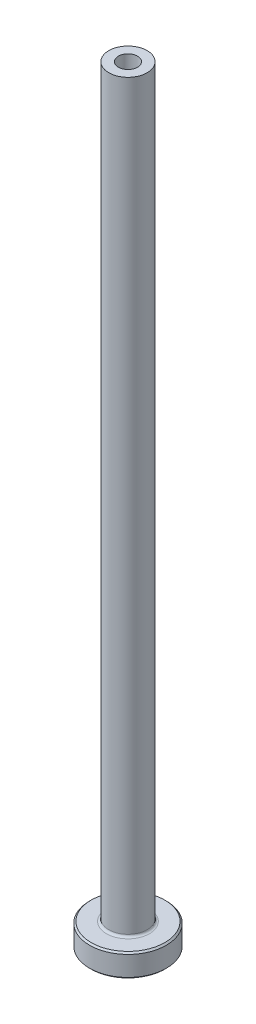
SolidWorks part; units mm, degrees
ref_plane "Front Plane" through (0, 0, 0) normal (0, 0, 1) x (1, 0, 0)
ref_plane "Top Plane" through (0, 0, 0) normal (0, 1, 0) x (1, 0, 0)
ref_plane "Right Plane" through (0, 0, 0) normal (1, 0, 0) x (0, 0, -1)
sketch "Sketch1" plane through (0, 0, 0) normal (0, 0, 1) x (1, 0, 0)
  line L0 (-1.25, 100) -> (-2.5, 100)
  line L1 (-2.5, 100) -> (-2.5, 3)
  line L2 (-2.5, 3) -> (-5, 3)
  line L3 (-5, 3) -> (-5, 0)
  line L4 (4.4, 0) -> (-4.4, 0) construction
  line L5 (-5, 0) -> (-1.5, 0)
  line L6 (-1.25, 65) -> (-1.25, 100)
  line L7 (0, 92.1877) -> (0, -15.5353) construction
  line L8 (0, -4.4) -> (0, 4.4) construction
  line L9 (-1.25, 65) -> (-1.5, 53)
  line L10 (-1.5, 53) -> (-1.5, 0)
  dimension "D1" = 0.25
  dimension "ID" = 2.5
  dimension "OD" = 5
  dimension "L" = 100
  dimension "H" = 10
  dimension "T" = 3
  dimension "N" = 35
  dimension "D2" = 12
revolve "Revolve1" add sketch "Sketch1" angle 360 about L7
fillet "Fillet1" radius 0.3 1 edges at (0, 3, 2.5)
chamfer "Chamfer1" distance 0.2 angle 45 2 edges at (0, 3, 5) (0, 0, 5)
chamfer "Chamfer3" distance 0.5 angle 45 1 edges at (0, 0, 1.5)
